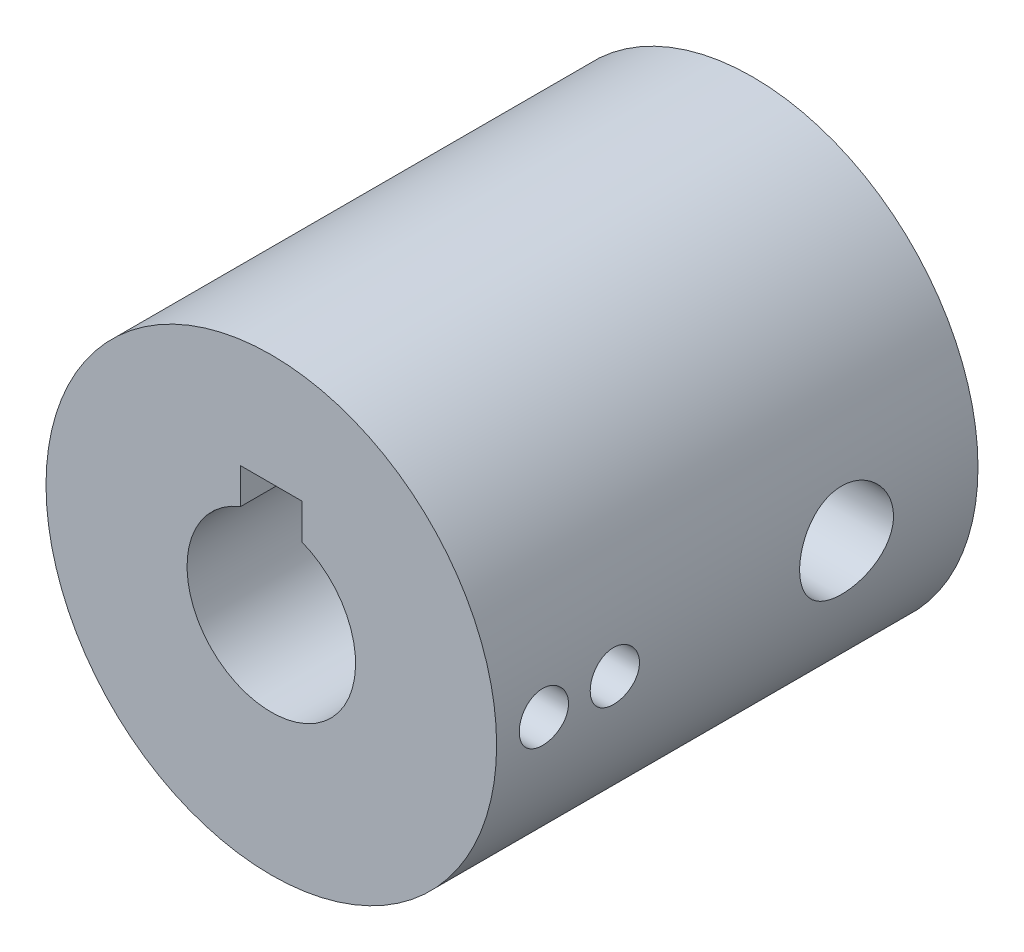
SolidWorks part; units mm, degrees
ref_plane "Front Plane" through (0, 0, 0) normal (0, 0, 1) x (1, 0, 0)
ref_plane "Top Plane" through (0, 0, 0) normal (0, 1, 0) x (1, 0, 0)
ref_plane "Right Plane" through (0, 0, 0) normal (1, 0, 0) x (0, 0, -1)
sketch "Sketch2" plane through (0, 0, 0) normal (0, 0, 1) x (1, 0, 0)
  circle A1 centre (0, 0) radius 19.05
  dimension "D1" = 38.1
extrude "Boss-Extrude1" add sketch "Sketch2" along normal blind 28
sketch "Sketch3" plane through (0, 0, 28) normal (0, 0, 1) x (1, 0, 0)
  circle A0 centre (0, 0) radius 19.05
  dimension "D1" = 38.1
extrude "Boss-Extrude2" add sketch "Sketch3" along normal blind 12.7
sketch "Sketch4" plane through (0, 0, 0) normal (0, 0, -1) x (-1, 0, 0)
  line L2 (-2.6, 6.6337) -> (-2.6, 9.6337)
  line L3 (-2.6, 9.6337) -> (2.6, 9.6337)
  line L4 (2.6, 6.6337) -> (2.6, 9.6337)
  arc A0 (-2.6, 6.6337) -> (2.6, 6.6337) centre (0, 0) ccw
  point P1 (0, 9.6337)
  dimension "D1" = 14.25
  dimension "D2" = 3
  dimension "D3" = 5.2
extrude "Cut-Extrude1" cut sketch "Sketch4" against normal through all
sketch "Sketch6" plane through (0, 0, 0) normal (1, 0, 0) x (0, 0, -1)
  circle A0 centre (-11.1125, 0) radius 3.9688
  circle A1 centre (-36.7037, 0) radius 2.083
  circle A2 centre (-30.7037, 0) radius 2.083
  dimension "D1" = 7.9375
  dimension "D3" = 4.166
  dimension "D5" = 6
  dimension "D2" = 11.1125
  dimension "D4" = 2
extrude "Cut-Extrude3" cut sketch "Sketch6" along normal blind 28.194
